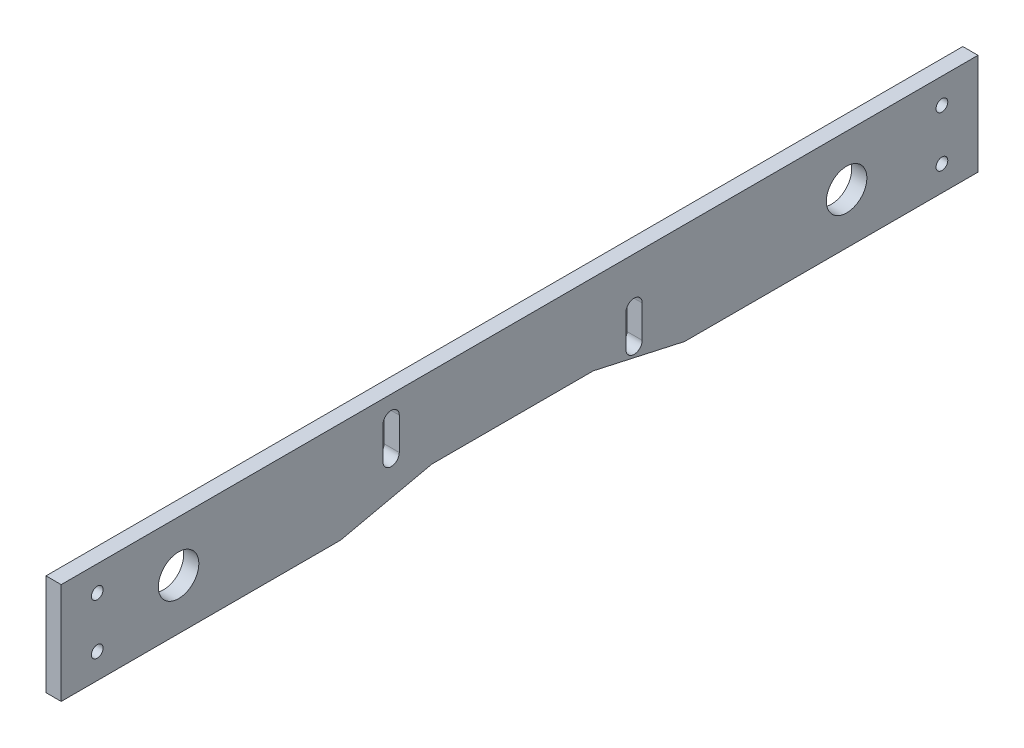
SolidWorks part; units mm, degrees
ref_plane "Front Plane" through (0, 0, 0) normal (0, 0, 1) x (1, 0, 0)
ref_plane "Top Plane" through (0, 0, 0) normal (0, 1, 0) x (1, 0, 0)
ref_plane "Right Plane" through (0, 0, 0) normal (1, 0, 0) x (0, 0, -1)
sketch "Sketch1" plane through (0, 0, 0) normal (1, 0, 0) x (0, 0, -1)
  line L1 (-143.7957, -15.875) -> (143.7957, -15.875)
  line L2 (-143.7957, -15.875) -> (-143.7957, 15.875)
  line L3 (-143.7957, 15.875) -> (143.7957, 15.875)
  line L4 (143.7957, -15.875) -> (143.7957, 15.875)
  line L5 (0, 15.875) -> (0, -15.875) construction
  line L6 (-143.7957, 0) -> (143.7957, 0) construction
  point P0 (0, 0)
  dimension "D1" = 31.75
  dimension "D2" = 287.5915
extrude "Boss-Extrude1" add sketch "Sketch1" along normal blind 4.7625
sketch "Sketch2" plane through (4.7625, 0, 0) normal (1, 0, 0) x (0, 0, -1)
  line L0 (-143.7957, 0) -> (143.7957, 0) construction
  line L1 (-143.7957, 15.875) -> (-143.7957, -15.875) construction
  line L2 (143.7957, -15.875) -> (143.7957, 15.875) construction
  line L3 (0, 0) -> (0, 19.05) construction
  line L4 (-143.7957, -15.875) -> (-143.7957, 253.619) construction
  circle A0 centre (-106.9657, 0) radius 6.35
  circle A1 centre (102.5842, 0) radius 6.35
  dimension "D1" = 12.7
  dimension "D3" = 209.55
  dimension "D2" = 36.83
extrude "Cut-Extrude1" cut sketch "Sketch2" against normal through all
sketch "Sketch3" plane through (0, 0, 0) normal (-1, 0, 0) x (0, 0, 1)
  line L1 (0, 0) -> (0, 15.875) construction
  line L2 (-143.7957, 15.875) -> (143.7957, 15.875) construction
  line L7 (-132.4737, 7.9375) -> (-132.4737, -7.9375) construction
  circle A2 centre (-132.4737, 7.9375) radius 1.8415
  circle A3 centre (-132.4737, -7.9375) radius 1.8415
  circle A22 centre (132.4737, -7.9375) radius 1.8415
  circle A23 centre (132.4737, 7.9375) radius 1.8415
  point P18 (-132.4737, 6.096)
extrude "Cut-Extrude2" cut sketch "Sketch3" against normal through all
sketch "Sketch4" plane through (0, 0, 0) normal (-1, 0, 0) x (0, 0, 1)
  line L3 (37.7381, 8.89) -> (37.7381, -1.27)
  line L4 (42.8435, -1.27) -> (42.8435, 8.89)
  line L5 (37.7381, 8.89) -> (37.7381, -1.27)
  line L6 (42.8435, -1.27) -> (42.8435, 8.89)
  line L8 (-38.4619, 1.27) -> (-38.4619, -8.89)
  line L9 (-33.3565, -8.89) -> (-33.3565, 1.27)
  line L10 (-38.4619, 1.27) -> (-38.4619, -8.89)
  line L11 (-33.3565, -8.89) -> (-33.3565, 1.27)
  arc A6 (42.8435, 8.89) -> (37.7381, 8.89) centre (40.2908, 8.89) ccw
  arc A7 (37.7381, -1.27) -> (42.8435, -1.27) centre (40.2908, -1.27) ccw
  arc A8 (42.8435, 8.89) -> (37.7381, 8.89) centre (40.2908, 8.89) ccw
  arc A9 (37.7381, -1.27) -> (42.8435, -1.27) centre (40.2908, -1.27) ccw
  arc A10 (-33.3565, 1.27) -> (-38.4619, 1.27) centre (-35.9092, 1.27) ccw
  arc A11 (-38.4619, -8.89) -> (-33.3565, -8.89) centre (-35.9092, -8.89) ccw
  arc A12 (-33.3565, 1.27) -> (-38.4619, 1.27) centre (-35.9092, 1.27) ccw
  arc A13 (-38.4619, -8.89) -> (-33.3565, -8.89) centre (-35.9092, -8.89) ccw
  dimension "D1" = 0
  dimension "D2" = 0
extrude "Cut-Extrude3" cut sketch "Sketch4" against normal through all
sketch "Sketch5" plane through (0, 0, 0) normal (-1, 0, 0) x (0, 0, 1)
  line L0 (-51.7842, -15.875) -> (-23.1413, -9.525)
  line L1 (143.7957, -15.875) -> (-143.7957, -15.875) construction
  line L2 (-23.1413, -9.525) -> (27.5228, -9.525)
  line L3 (27.5228, -9.525) -> (56.1658, -15.875)
  line L4 (56.1658, -15.875) -> (-51.7842, -15.875)
  arc A0 (-51.7842, -15.875) -> (56.1658, -15.875) centre (2.1908, -242.0938) cw construction
  point P4 (106.9657, 0)
  point P10 (-102.5842, 0)
  dimension "D4" = 12.5
  dimension "D1" = 50.8
  dimension "D2" = 50.8
  dimension "D3" = 6.35
extrude "Cut-Extrude4" cut sketch "Sketch5" against normal through all
